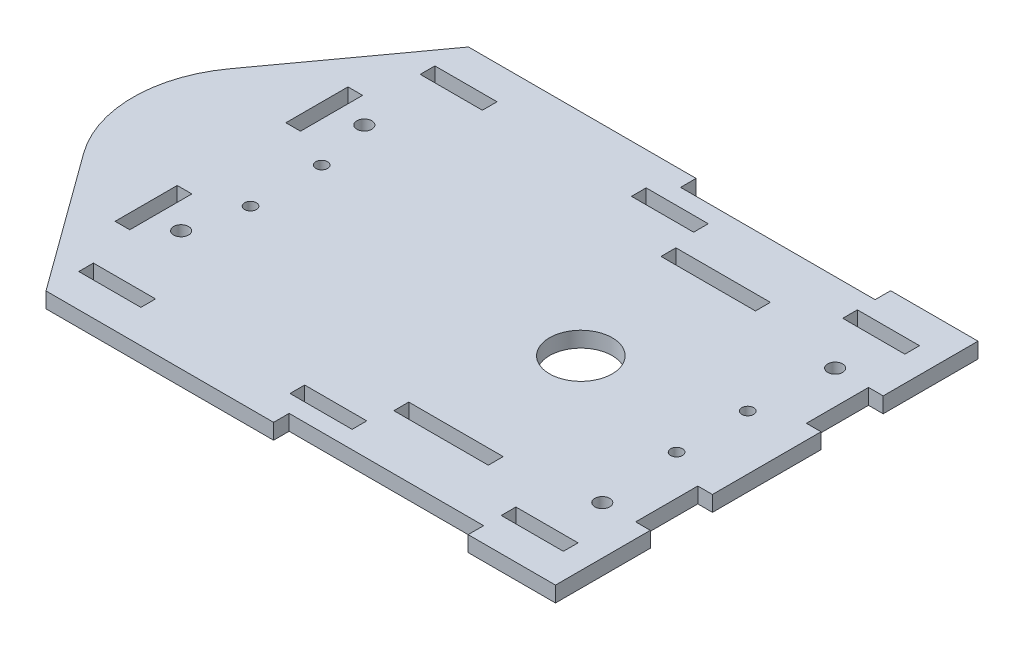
SolidWorks part; units mm, degrees
ref_plane "Front Plane" through (0, 0, 0) normal (0, 0, 1) x (1, 0, 0)
ref_plane "Top Plane" through (0, 0, 0) normal (0, 1, 0) x (1, 0, 0)
ref_plane "Right Plane" through (0, 0, 0) normal (1, 0, 0) x (0, 0, -1)
sketch "Sketch1" plane through (0, 0, 0) normal (0, 1, 0) x (1, 0, 0)
  line L0 (-49.4372, 0) -> (-74.8372, 0) construction
  line L1 (2.7689, -43.18) -> (-49.4407, -43.18)
  line L2 (49.53, -23.7998) -> (51.7021, -23.7998) construction
  line L3 (-49.4407, 43.18) -> (2.7689, 43.18)
  line L4 (54.6993, -23.7998) -> (54.6993, -43.18)
  line L5 (54.6993, 0) -> (-49.4372, 0) construction
  line L6 (-49.53, -27.2364) -> (-49.53, -33.401) construction
  line L7 (-69.9792, 14.9395) -> (-49.4407, 43.18)
  line L8 (-69.9792, -14.9395) -> (-49.4407, -43.18)
  line L9 (49.53, -27.2364) -> (44.8818, -27.2364)
  line L10 (-49.53, -27.2364) -> (49.53, -27.2364) construction
  line L11 (-49.53, -27.2364) -> (-49.53, 26.8656) construction
  line L12 (-49.53, 26.8656) -> (49.53, 26.8656) construction
  line L13 (49.53, -27.2364) -> (49.53, 26.8656) construction
  line L14 (49.53, -27.2364) -> (49.53, -23.7998)
  line L15 (30.6353, -43.18) -> (54.6993, -43.18)
  line L16 (54.6993, -11.0998) -> (54.6993, 11.0998)
  line L17 (0, -27.2364) -> (0, -33.401) construction
  line L18 (-49.53, -33.401) -> (-36.83, -33.401)
  line L19 (-49.53, -33.401) -> (-49.53, -36.3982)
  line L20 (-49.53, -36.3982) -> (-36.83, -36.3982)
  line L21 (-36.83, -33.401) -> (-36.83, -36.3982)
  line L22 (0, -33.401) -> (0, -36.3982) construction
  line L23 (6.35, -33.401) -> (-6.35, -33.401)
  line L24 (6.35, -33.401) -> (6.35, -36.3982)
  line L25 (6.35, -36.3982) -> (-6.35, -36.3982)
  line L26 (-6.35, -33.401) -> (-6.35, -36.3982)
  line L27 (0, -27.2364) -> (0, 26.8656) construction
  line L28 (49.53, -27.2364) -> (49.53, -33.401) construction
  line L29 (36.83, -33.401) -> (36.83, -36.3982)
  line L30 (49.53, -36.3982) -> (36.83, -36.3982)
  line L31 (49.53, -33.401) -> (49.53, -36.3982)
  line L32 (49.53, -33.401) -> (36.83, -33.401)
  line L33 (-54.6993, -23.7998) -> (-54.6993, -11.0998)
  line L34 (51.7021, -23.7998) -> (54.6993, -23.7998)
  line L35 (51.7021, -23.7998) -> (51.7021, -11.0998)
  line L36 (51.7021, -11.0998) -> (54.6993, -11.0998)
  line L37 (54.6993, 23.7998) -> (54.6993, 43.18)
  line L38 (-51.7021, -11.0998) -> (-54.6993, -11.0998)
  line L39 (-51.7021, -23.7998) -> (-51.7021, -11.0998)
  line L40 (-51.7021, -23.7998) -> (-54.6993, -23.7998)
  line L41 (49.53, 27.2364) -> (49.53, 33.401) construction
  line L42 (0, 33.401) -> (0, 36.3982) construction
  line L43 (0, 27.2364) -> (0, 33.401) construction
  line L44 (-49.53, 27.2364) -> (-49.53, 33.401) construction
  line L45 (49.53, 33.401) -> (36.83, 33.401)
  line L46 (49.53, 33.401) -> (49.53, 36.3982)
  line L47 (49.53, 36.3982) -> (36.83, 36.3982)
  line L48 (36.83, 33.401) -> (36.83, 36.3982)
  line L49 (-6.35, 33.401) -> (-6.35, 36.3982)
  line L50 (6.35, 36.3982) -> (-6.35, 36.3982)
  line L51 (6.35, 33.401) -> (6.35, 36.3982)
  line L52 (6.35, 33.401) -> (-6.35, 33.401)
  line L53 (-36.83, 33.401) -> (-36.83, 36.3982)
  line L54 (-49.53, 36.3982) -> (-36.83, 36.3982)
  line L55 (-49.53, 33.401) -> (-49.53, 36.3982)
  line L56 (-49.53, 33.401) -> (-36.83, 33.401)
  line L57 (30.6353, 43.18) -> (54.6993, 43.18)
  line L58 (51.7021, 11.0998) -> (54.6993, 11.0998)
  line L59 (51.7021, 23.7998) -> (51.7021, 11.0998)
  line L60 (51.7021, 23.7998) -> (54.6993, 23.7998)
  line L61 (49.53, 27.2364) -> (49.53, -26.8656) construction
  line L62 (-51.7021, 23.7998) -> (-54.6993, 23.7998)
  line L63 (-51.7021, 23.7998) -> (-51.7021, 11.0998)
  line L64 (-51.7021, 11.0998) -> (-54.6993, 11.0998)
  line L65 (-54.6993, 23.7998) -> (-54.6993, 11.0998)
  line L66 (-43.54, 0) -> (-43.54, 7.2719) construction
  line L67 (51.7021, -23.7998) -> (16.7021, -23.7998) construction
  line L68 (16.7021, -23.7998) -> (16.7021, -43.18) construction
  line L69 (2.7689, -40.005) -> (2.7689, -43.18)
  line L72 (11.8126, -40.005) -> (21.5916, -40.005)
  line L73 (11.8126, 40.005) -> (21.5916, 40.005)
  line L74 (21.5916, -40.005) -> (30.6353, -40.005)
  line L77 (30.6353, -40.005) -> (30.6353, -43.18)
  line L78 (11.8126, -40.005) -> (2.7689, -40.005)
  line L81 (11.8126, 40.005) -> (2.7689, 40.005)
  line L82 (30.6353, 40.005) -> (30.6353, 43.18)
  line L85 (21.5916, 40.005) -> (30.6353, 40.005)
  line L90 (2.7689, 40.005) -> (2.7689, 43.18)
  arc A0 (-69.9792, 14.9395) -> (-69.9792, -14.9395) centre (-49.4372, 0) ccw
  circle A1 centre (44.8818, -23.7998) radius 1.524
  circle A2 centre (-46.2788, -18.7198) radius 1.524
  circle A3 centre (44.8818, 23.7998) radius 1.524
  circle A4 centre (-46.2788, 18.7198) radius 1.524
  circle A5 centre (-43.54, 7.2719) radius 1.2065
  circle A6 centre (-43.54, -7.2719) radius 1.2065
  circle A7 centre (43.54, -7.2719) radius 1.2065
  circle A8 centre (43.54, 7.2719) radius 1.2065
  circle A9 centre (16.7021, 0) radius 6.4043
  point P0 (0, 0)
  point P6 (0, 0)
  dimension "D4" = 25.4
  dimension "D3" = 25.4
  dimension "D7" = 9.0437
  dimension "D5" = 35
  dimension "D6" = 3.175
  dimension "D1" = 104.14
  dimension "D2" = 86.36
extrude "Extrude2" add sketch "Sketch1" along normal blind 3.175
sketch "Sketch2" plane through (0, 3.175, 0) normal (0, 1, 0) x (1, 0, 0)
  line L0 (-74.8372, 0) -> (54.6993, 0) construction
  line L1 (36.8382, -40.005) -> (-2.9199, -40.005)
  line L2 (36.8382, -40.005) -> (36.8382, -43.18)
  line L3 (36.8382, -43.18) -> (-2.9199, -43.18)
  line L4 (-2.9199, -40.005) -> (-2.9199, -43.18)
  line L6 (54.6993, -11.0998) -> (54.6993, 11.0998) construction
  line L7 (-2.9199, 40.005) -> (-2.9199, 43.18)
  line L8 (36.8382, 43.18) -> (-2.9199, 43.18)
  line L9 (36.8382, 40.005) -> (36.8382, 43.18)
  line L10 (36.8382, 40.005) -> (-2.9199, 40.005)
  line L13 (36.83, -36.3982) -> (36.8382, -40.005) construction
  arc A0 (-69.9792, 14.9395) -> (-69.9792, -14.9395) centre (-49.4372, 0) ccw construction
extrude "Extrude4" cut sketch "Sketch2" against normal blind 3.175
sketch "Sketch3" plane through (0, 3.175, 0) normal (0, 1, 0) x (-1, 0, 0)
  line L0 (-16.9591, -40.005) -> (-16.9591, -27.305) construction
  line L3 (2.9199, -40.005) -> (-36.8382, -40.005) construction
  line L4 (-54.6993, 0) -> (74.8372, 0) construction
  line L5 (-7.3071, -25.781) -> (-26.6111, -25.781)
  line L6 (-7.3071, -25.781) -> (-7.3071, -28.829)
  line L7 (-7.3071, -28.829) -> (-26.6111, -28.829)
  line L8 (-26.6111, -25.781) -> (-26.6111, -28.829)
  line L9 (-7.3071, -25.781) -> (-26.6111, -28.829) construction
  line L10 (-7.3071, -28.829) -> (-26.6111, -25.781) construction
  line L11 (-54.6993, 11.0998) -> (-54.6993, -11.0998) construction
  line L12 (-7.3071, 28.829) -> (-26.6111, 25.781) construction
  line L13 (-7.3071, 25.781) -> (-26.6111, 28.829) construction
  line L14 (-26.6111, 25.781) -> (-26.6111, 28.829)
  line L15 (-7.3071, 28.829) -> (-26.6111, 28.829)
  line L16 (-7.3071, 25.781) -> (-7.3071, 28.829)
  line L17 (-7.3071, 25.781) -> (-26.6111, 25.781)
  arc A0 (69.9792, -14.9395) -> (69.9792, 14.9395) centre (49.4372, 0) ccw construction
  dimension "D1" = 12.7
  dimension "D2" = 19.304
  dimension "D3" = 3.048
extrude "Extrude5" cut sketch "Sketch3" against normal blind 3.175
